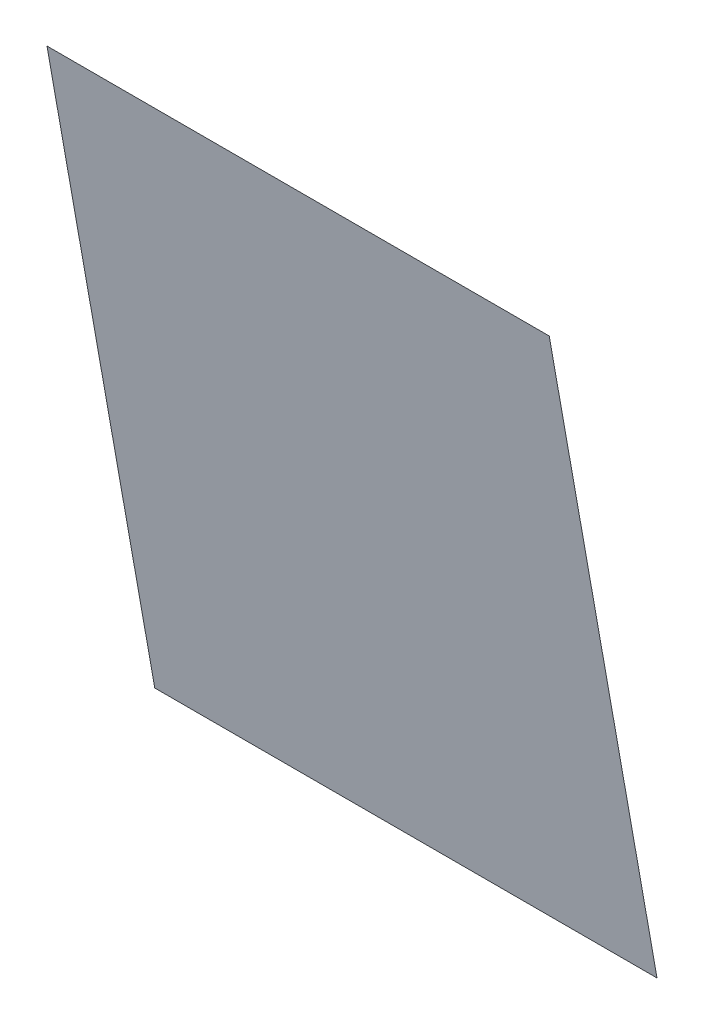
SolidWorks part; units mm, degrees
ref_plane "Ebene vorne" through (0, 0, 0) normal (0, 0, 1) x (1, 0, 0)
ref_plane "Ebene oben" through (0, 0, 0) normal (0, 1, 0) x (1, 0, 0)
ref_plane "Ebene rechts" through (0, 0, 0) normal (1, 0, 0) x (0, 0, -1)
sketch "Skizze1" plane through (0, 0, 0) normal (0, 0, 1) x (1, 0, 0)
  line L0 (0, 0) -> (40, 0) construction
  line L1 (0.4925, 6.2574) -> (40, 0) construction
  line L2 (1.9577, 12.3607) -> (40, 0) construction
  line L3 (4.3597, 18.1596) -> (40, 0) construction
  line L4 (7.6393, 23.5114) -> (40, 0) construction
  line L5 (11.7157, 28.2843) -> (40, 0) construction
  line L6 (0, 0) -> (0.4925, 6.2574)
  line L7 (0.4925, 6.2574) -> (1.9577, 12.3607)
  line L8 (1.9577, 12.3607) -> (4.3597, 18.1596)
  line L9 (4.3597, 18.1596) -> (7.6393, 23.5114)
  line L10 (7.6393, 23.5114) -> (11.7157, 28.2843)
  arc A0 (11.7157, 28.2843) -> (0, 0) centre (40, 0) ccw construction
  dimension "D1" = 40
  dimension "D2" = 45
ref_plane "Ebene1" through (0.4925, 6.2574, 0) normal (-0.1564, -0.9877, 0) x (0.9877, -0.1564, 0)
ref_plane "Ebene2" through (1.9577, 12.3607, 0) normal (-0.309, -0.9511, 0) x (0.9511, -0.309, 0)
ref_plane "Ebene3" through (4.3597, 18.1596, 0) normal (-0.454, -0.891, 0) x (0.891, -0.454, 0)
ref_plane "Ebene4" through (7.6393, 23.5114, 0) normal (-0.5878, -0.809, 0) x (0.809, -0.5878, 0)
ref_plane "Ebene5" through (11.7157, 28.2843, 0) normal (-0.7071, -0.7071, 0) x (0.7071, -0.7071, 0)
sketch "Skizze2" plane through (0, 0, 0) normal (0, 1, 0) x (1, 0, 0)
  line L0 (-12.5045, -20) -> (12.5045, -20) construction
  circle A0 centre (0, 0) radius 20
  point P3 (0, -20)
  point P4 (20, 0)
  point P5 (0, 20)
  point P6 (-20, 0)
  dimension "D1" = 40
sketch "Skizze3" plane through (11.7157, 28.2843, 0) normal (-0.7071, -0.7071, 0) x (0.7071, -0.7071, 0)
  circle A0 centre (0, 0) radius 25
  point P3 (25, 0)
  point P4 (0, -25)
  point P5 (-25, 0)
  point P6 (0, 25)
  dimension "D1" = 50
ref_plane "Ebene6" through (0, -3.4284, 19.3939) normal (0, -0.1741, 0.9847) x (1, 0, 0)
sketch "Skizze6" plane through (0, -3.4284, 19.3939) normal (0, -0.1741, 0.9847) x (1, 0, 0)
  line L1 (-11.317, 37.4794) -> (18.4566, 37.4794)
  line L2 (-11.317, 37.4794) -> (-11.317, 0.7633)
  line L3 (-11.317, 0.7633) -> (18.4566, 0.7633)
  line L4 (18.4566, 37.4794) -> (18.4566, 0.7633)
surface "Oberfläche-Ebene1" sketch "Skizze6"
curve "Kurve1"
sketch "Skizze4" plane through (0.4925, 6.2574, 0) normal (-0.1564, -0.9877, 0) x (0.9877, -0.1564, 0)
  circle A0 centre (0, 0) radius 21.1062
  point P3 (-21.1062, 0)
  point P4 (0, -21.1062)
  point P6 (21.1062, 0)
  point P8 (0, 21.1062)
sketch "Skizze7" plane through (1.9577, 12.3607, 0) normal (-0.309, -0.9511, 0) x (0.9511, -0.309, 0)
  circle A0 centre (0, 0) radius 22.1851
  point P2 (0, 22.1851)
  point P3 (-22.1851, 0)
  point P4 (0, -22.1851)
  point P5 (22.1851, 0)
sketch "Skizze8" plane through (4.3597, 18.1596, 0) normal (-0.454, -0.891, 0) x (0.891, -0.454, 0)
  line L0 (0, 0) -> (40, 0) construction
  circle A0 centre (0, 0) radius 23.2102
  point P3 (0, 23.2102)
  point P4 (-23.2102, 0)
  point P5 (0, -23.2102)
  point P6 (21.7221, 0)
sketch "Skizze9" plane through (7.6393, 23.5114, 0) normal (-0.5878, -0.809, 0) x (0.809, -0.5878, 0)
  circle A0 centre (0, 0) radius 24.1563
  point P3 (-24.1563, 0)
  point P4 (0, -24.1563)
  point P5 (24.1563, 0)
  point P6 (0, 24.1563)
